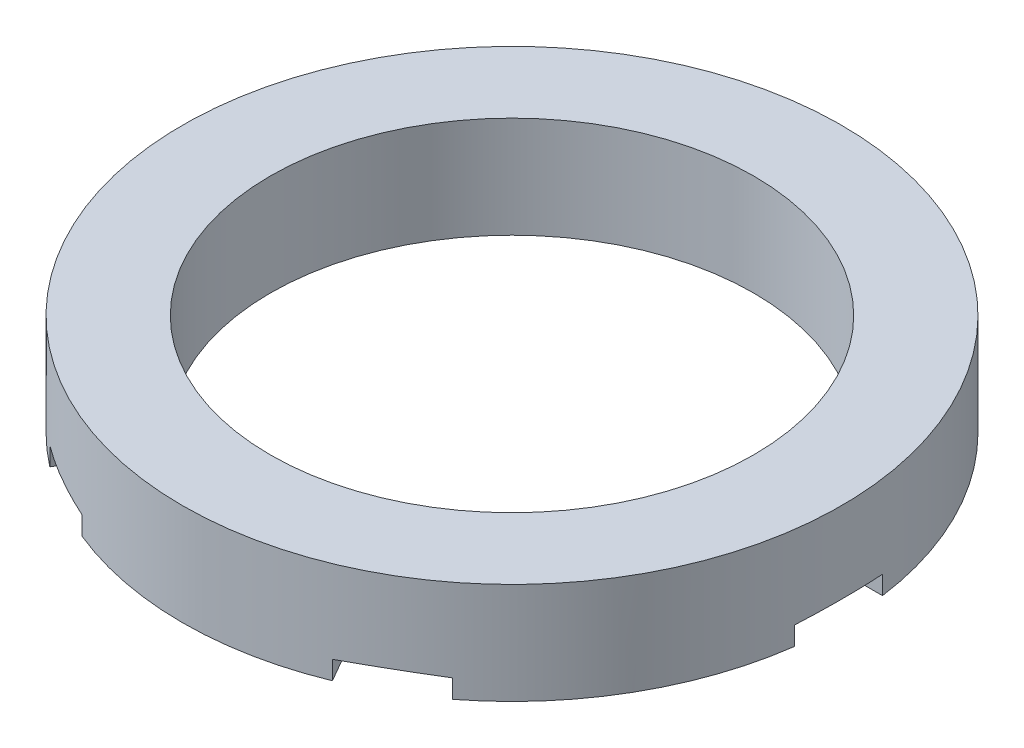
SolidWorks part; units mm, degrees
ref_plane "Plan de face" through (0, 0, 0) normal (0, 0, 1) x (1, 0, 0)
ref_plane "Plan de dessus" through (0, 0, 0) normal (0, 1, 0) x (1, 0, 0)
ref_plane "Plan de droite" through (0, 0, 0) normal (1, 0, 0) x (0, 0, -1)
sketch "Esquisse1" plane through (0, 0, 0) normal (0, 1, 0) x (1, 0, 0)
  circle A0 centre (0, 0) radius 27.5
  circle A1 centre (0, 0) radius 37.5
  dimension "D1" = 55
  dimension "D2" = 75
extrude "Extrusion1" add sketch "Esquisse1" along normal blind 11.54
sketch "Esquisse2" plane through (0, 0, 0) normal (0, 0, 1) x (1, 0, 0)
  line L0 (-37.5, 2.31) -> (-33.499, 0)
  line L1 (-37.5, 0) -> (37.5, 0) construction
  line L2 (-33.499, 0) -> (-37.5, 0)
  line L3 (-37.5, 0) -> (-37.5, 2.31)
  line L4 (-37.5, 11.54) -> (-37.5, 0) construction
  dimension "D1" = 30
  dimension "D2" = 2.31
extrude "Extrusion2" cut sketch "Esquisse2" against normal mid plane 10
pattern_circular "Répétition circulaire1" count 6 over 360 about axis through (0, 0, 0) along (0, 1, 0) of "Extrusion2"
